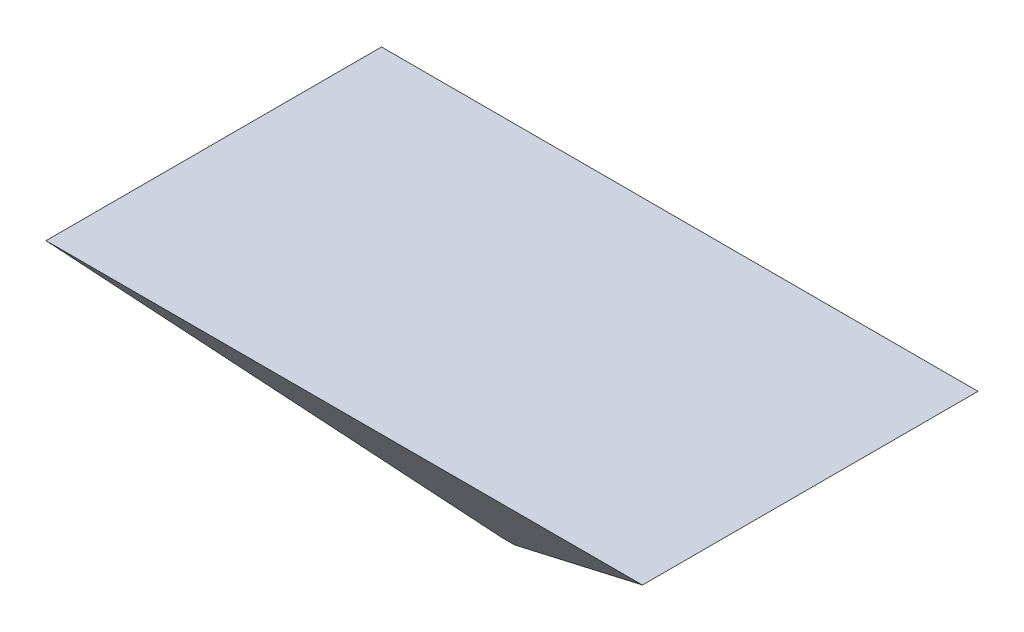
SolidWorks part; units mm, degrees
ref_plane "Front Plane" through (0, 0, 0) normal (0, 0, 1) x (1, 0, 0)
ref_plane "Top Plane" through (0, 0, 0) normal (0, 1, 0) x (1, 0, 0)
ref_plane "Right Plane" through (0, 0, 0) normal (1, 0, 0) x (0, 0, -1)
ref_plane "Plane2" through (0, 50, 0) normal (0, 1, 0) x (1, 0, 0)
sketch "Sketch2" plane through (0, 50, 0) normal (0, 1, 0) x (1, 0, 0)
  line L1 (-0.8889, 0.5) -> (0.8889, 0.5)
  line L2 (-0.8889, 0.5) -> (-0.8889, -0.5)
  line L3 (-0.8889, -0.5) -> (0.8889, -0.5)
  line L4 (0.8889, 0.5) -> (0.8889, -0.5)
  line L5 (-0.8889, 0.5) -> (0.8889, -0.5) construction
  line L6 (-0.8889, -0.5) -> (0.8889, 0.5) construction
  point P0 (0, 0)
  dimension "D1" = 1
  dimension "D2" = 1.7778
ref_plane "Plane1" through (0, 0, 0) normal (-0.4903, 0, 0.8716) x (0.8716, 0, 0.4903)
sketch "Sketch3" plane through (0, 0, 0) normal (-0.4903, 0, 0.8716) x (0.8716, 0, 0.4903)
  line L0 (-86.6025, 50) -> (0, 0)
  line L1 (0, 0) -> (86.6025, 50)
  line L2 (0, -1000) -> (0, 49000) construction
  line L3 (-1.0199, 50) -> (1.0199, 50) construction
  point P2 (1.151, -0.2288)
  point P6 (0, 0)
  point P9 (0, 0)
  point P12 (0.9741, -0.0264)
  point P13 (-1.093, 0)
  point P14 (0, 0)
  point P17 (0, 0)
  point P18 (0, -0.6162)
  point P19 (0, 0)
ref_plane "Plane3" through (0, 0, 0) normal (0.4903, 0, 0.8716) x (0.8716, 0, -0.4903)
sketch "Sketch4" plane through (0, 0, 0) normal (0.4903, 0, 0.8716) x (0.8716, 0, -0.4903)
  line L0 (-86.6025, 50) -> (0, 0)
  line L1 (0, 0) -> (86.6025, 50)
  line L2 (0, -1000) -> (0, 49000) construction
  line L4 (-1.0199, 50) -> (1.0199, 50) construction
  point P2 (1.151, -0.2288)
  point P6 (0, 0)
  point P8 (0, 0)
  point P9 (0, 0)
  point P10 (0, 0)
  point P12 (0.9741, -0.0264)
  point P13 (-1.093, 0)
  point P14 (0, 0)
  point P16 (0, 0)
  point P17 (0, 0)
  point P18 (0, -0.6162)
  point P19 (0, 0)
  dimension "D1" = 120
  dimension "D2" = 60
sketch "Sketch5" plane through (0, 50, 0) normal (0, 1, 0) x (1, 0, 0)
  line L0 (-75.4807, 42.4579) -> (75.4807, 42.4579)
  line L1 (-75.4807, 42.4579) -> (0, 0) construction
  line L2 (0, 0) -> (75.4807, 42.4579) construction
  line L3 (75.4807, 42.4579) -> (75.4807, -42.4579)
  line L4 (0, 0) -> (75.4807, -42.4579) construction
  line L5 (75.4807, -42.4579) -> (-75.4807, -42.4579)
  line L6 (-75.4807, -42.4579) -> (0, 0) construction
  line L7 (-75.4807, -42.4579) -> (-75.4807, 42.4579)
  point P6 (-74.1654, 41.718)
  point P13 (0, 0)
ref_plane "Plane4" through (0, 1, 0) normal (0, 1, 0) x (1, 0, 0)
sketch "Sketch6" plane through (0, 1, 0) normal (0, 1, 0) x (1, 0, 0)
  line L0 (-1.5096, 0.8492) -> (1.5096, 0.8492)
  line L1 (-75.4807, 42.4579) -> (0, 0) construction
  line L2 (0, 0) -> (75.4807, 42.4579) construction
  line L3 (1.5096, 0.8492) -> (1.5096, -0.8492)
  line L4 (0, 0) -> (75.4807, -42.4579) construction
  line L5 (1.5096, -0.8492) -> (-1.5096, -0.8492)
  line L6 (-75.4807, -42.4579) -> (0, 0) construction
  line L7 (-1.5096, -0.8492) -> (-1.5096, 0.8492)
  point P6 (0, 0)
loft "Loft1" add profiles "Sketch5", "Sketch6"
equation "\"D2@Sketch3\"=\"D1@Sketch3\"/2"
